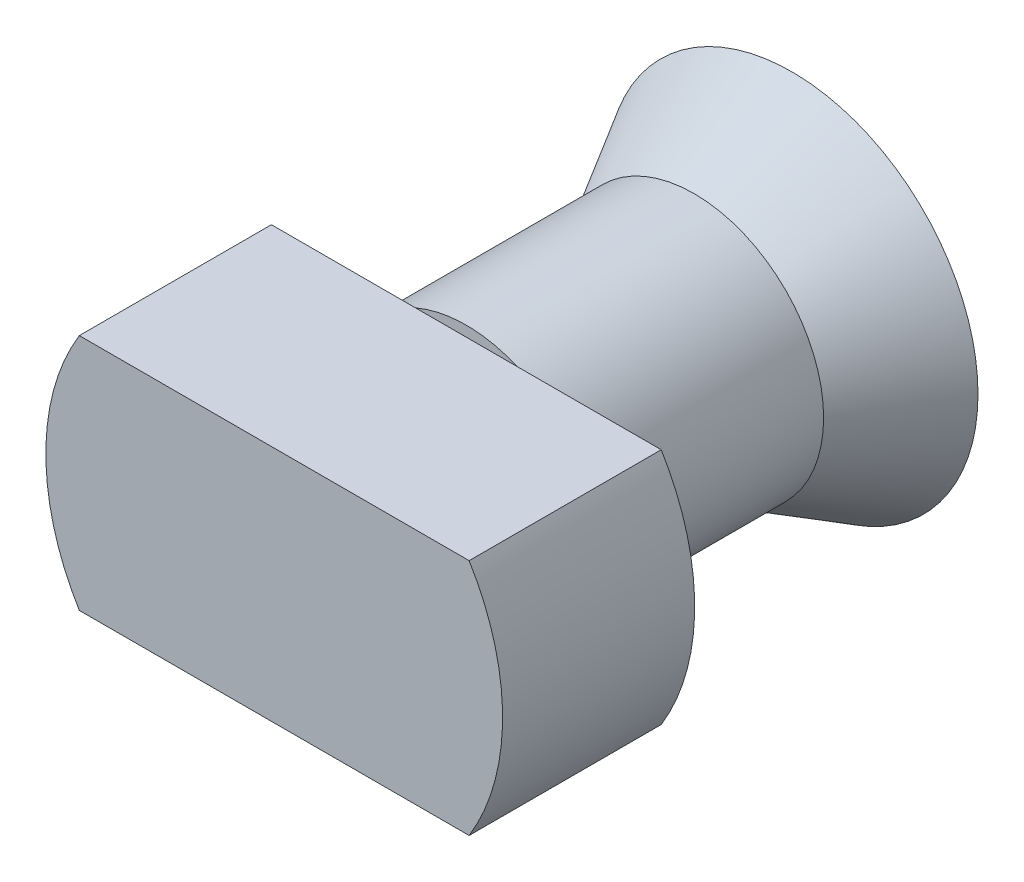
SolidWorks part; units mm, degrees
ref_plane "Спереди" through (0, 0, 0) normal (0, 0, 1) x (1, 0, 0)
ref_plane "Сверху" through (0, 0, 0) normal (0, 1, 0) x (1, 0, 0)
ref_plane "Справа" through (0, 0, 0) normal (1, 0, 0) x (0, 0, -1)
sketch "Эскиз1" plane through (0, 0, 0) normal (1, 0, 0) x (0, 0, -1)
  line L0 (0, 0) -> (26.6987, 0) construction
  line L1 (0, 0) -> (0, 2.7781)
  line L2 (0, 2.7781) -> (2.3368, 2.7781)
  line L3 (2.3368, 2.7781) -> (2.3368, 1.5748)
  line L4 (2.3368, 1.5748) -> (5.1086, 1.5748)
  line L5 (5.1086, 1.5748) -> (6.2992, 2.2622)
  line L6 (6.2992, 2.2622) -> (6.2992, 0)
  line L7 (6.2992, 0) -> (0, 0)
  dimension "D1" = 1.1906
  dimension "D2" = 30
  dimension "D3" = 3.9624
  dimension "D4" = 2.3368
  dimension "D5" = 3.1496
  dimension "D6" = 5.5562
revolve "Повернуть1" add sketch "Эскиз1" angle 360 about L0
sketch "Эскиз2" plane through (0, 0, 0) normal (0, 0, 1) x (1, 0, 0)
  line L0 (-2.371, 1.4478) -> (2.371, 1.4478)
  line L1 (-13.6417, -13.1318) -> (8.8519, -13.1318) construction
  line L2 (2.371, -1.4478) -> (-2.371, -1.4478)
  line L3 (-4.7536, 0) -> (5.5675, 0) construction
  arc A0 (-2.371, -1.4478) -> (2.371, -1.4478) centre (0, 0) ccw
  circle A1 centre (0, 0) radius 2.7781 construction
  arc A2 (2.371, 1.4478) -> (-2.371, 1.4478) centre (0, 0) ccw
  dimension "D1" = 2.8956
  dimension "D2" = 14.5796
  dimension "D3" = 13.1318
extrude "Вырез-Вытянуть1" cut sketch "Эскиз2" against normal up to surface (2.3368 mm away)
